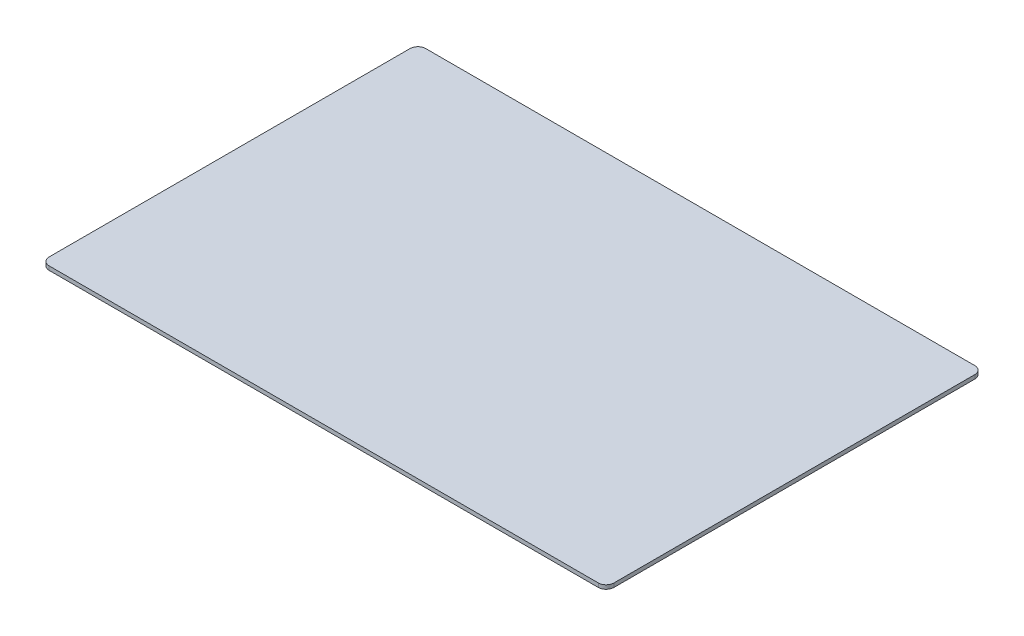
SolidWorks part; units mm, degrees
ref_plane "Front Plane" through (0, 0, 0) normal (0, 0, 1) x (1, 0, 0)
ref_plane "Top Plane" through (0, 0, 0) normal (0, 1, 0) x (1, 0, 0)
ref_plane "Right Plane" through (0, 0, 0) normal (1, 0, 0) x (0, 0, -1)
sketch "Sketch1" plane through (0, 0, 0) normal (0, 1, 0) x (1, 0, 0)
  line L1 (-228.6, -152.4) -> (228.6, -152.4)
  line L2 (-228.6, -152.4) -> (-228.6, 152.4)
  line L3 (-228.6, 152.4) -> (228.6, 152.4)
  line L4 (228.6, -152.4) -> (228.6, 152.4)
  line L5 (-228.6, -152.4) -> (228.6, 152.4) construction
  line L6 (-228.6, 152.4) -> (228.6, -152.4) construction
  point P0 (0, 0)
  dimension "D1" = 457.2
  dimension "D2" = 304.8
extrude "Boss-Extrude1" add sketch "Sketch1" along normal blind 3.175
fillet "Fillet1" radius 6.35 4 edges at (-228.6, 1.5875, -152.4) (228.6, 1.5875, -152.4) (228.6, 1.5875, 152.4) (-228.6, 1.5875, 152.4)
